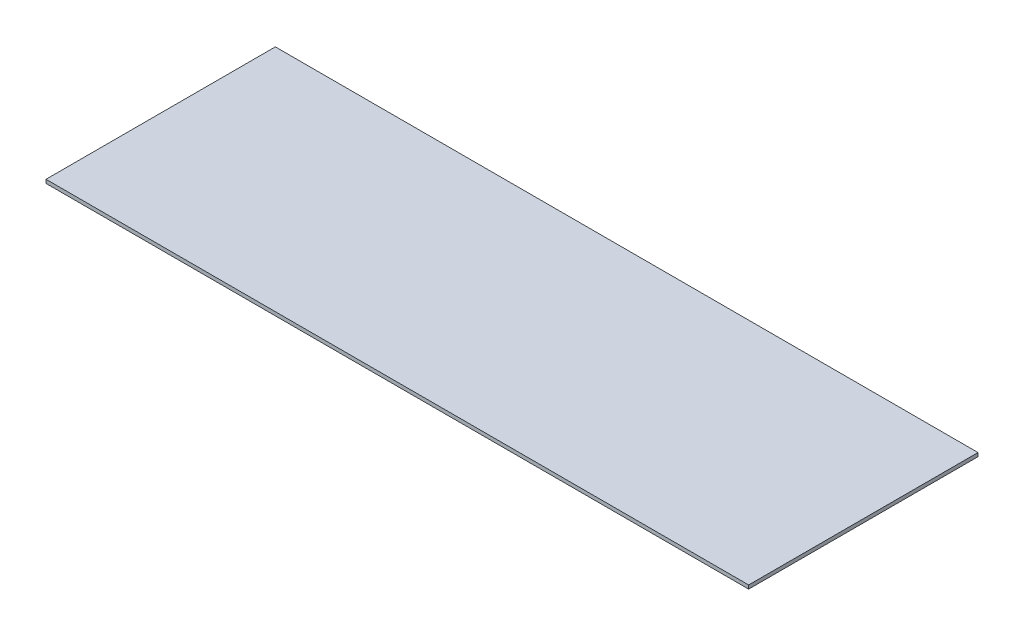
SolidWorks part; units mm, degrees
ref_plane "Front Plane" through (0, 0, 0) normal (1, 0, 0) x (0, 1, 0)
ref_plane "Top Plane" through (0, 0, 0) normal (0, 0, 1) x (0, 1, 0)
ref_plane "Right Plane" through (0, 0, 0) normal (0, 1, 0) x (-1, 0, 0)
sketch "Sketch1" plane through (0, 0, 0) normal (1, 0, 0) x (0, 1, 0)
  line L1 (-78.5622, -76.2) -> (-76.2, -76.2)
  line L2 (-78.5622, -76.2) -> (-78.5622, 73.025)
  line L3 (-78.5622, 73.025) -> (-76.2, 73.025)
  line L4 (-76.2, -76.2) -> (-76.2, 73.025)
extrude "Panel_or_block" add sketch "Sketch1" along normal blind 457.2
